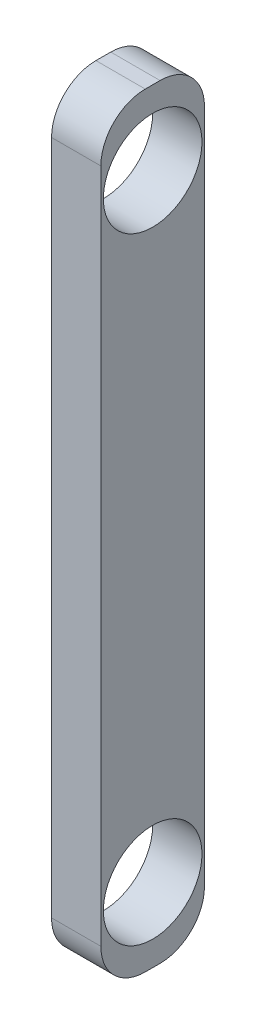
SolidWorks part; units mm, degrees
ref_plane "Front Plane" through (0, 0, 0) normal (0, 0, 1) x (1, 0, 0)
ref_plane "Top Plane" through (0, 0, 0) normal (0, 1, 0) x (1, 0, 0)
ref_plane "Right Plane" through (0, 0, 0) normal (1, 0, 0) x (0, 0, -1)
sketch "Sketch1" plane through (0, 0, 0) normal (1, 0, 0) x (0, 0, -1)
  line L0 (-2.1, 0) -> (2.1, 0)
  line L1 (2.1, 0) -> (2.1, 31)
  line L2 (2.1, 31) -> (-2.1, 31)
  line L3 (-2.1, 31) -> (-2.1, 0)
  line L4 (0, 31) -> (0, 0) construction
  circle A0 centre (0, 28) radius 2
  circle A1 centre (0, 3) radius 2
  dimension "D3" = 3
  dimension "D4" = 4
  dimension "D5" = 4
  dimension "D6" = 3
  dimension "4" = 4.2
  dimension "D2" = 31
extrude "Boss-Extrude1" add sketch "Sketch1" along normal blind 2
fillet "Fillet1" radius 1.8 4 edges at (1, 0, 2.1) (1, 0, -2.1) (1, 31, 2.1) (1, 31, -2.1)
